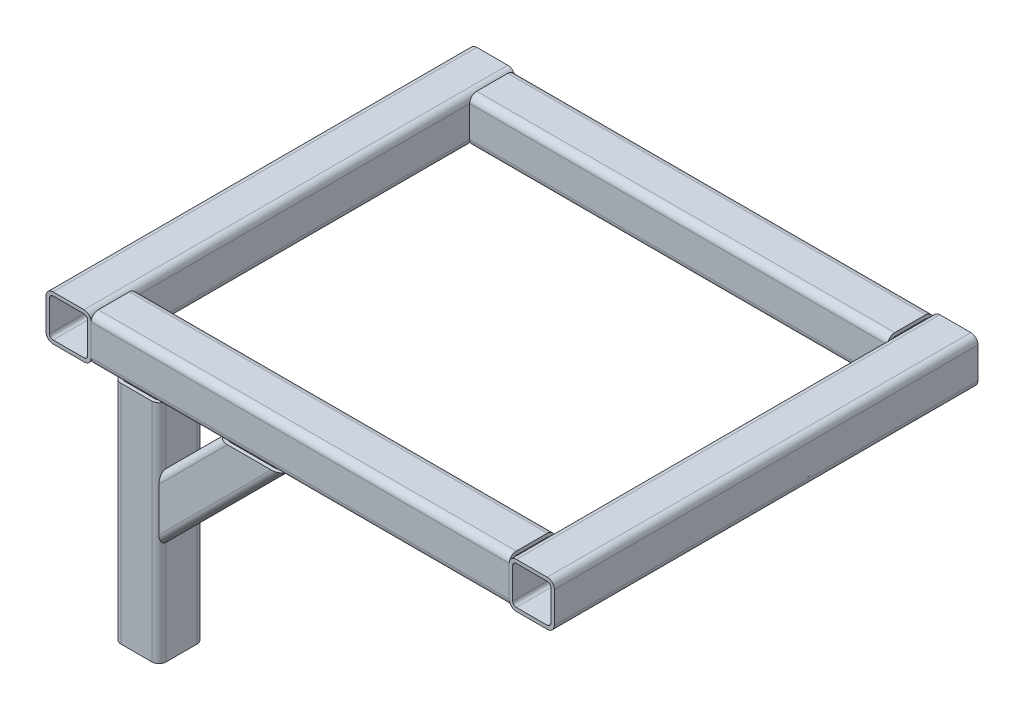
SolidWorks part; units mm, degrees
ref_plane "Front Plane" through (0, 0, 0) normal (0, 0, 1) x (1, 0, 0)
ref_plane "Top Plane" through (0, 0, 0) normal (0, 1, 0) x (1, 0, 0)
ref_plane "Right Plane" through (0, 0, 0) normal (1, 0, 0) x (0, 0, -1)
ref_plane "Top of Frame" through (0, 500, 0) normal (0, 1, 0) x (1, 0, 0)
ref_plane "Bottom of Legs" through (0, 20, 0) normal (0, 1, 0) x (1, 0, 0)
sketch "Upper Frame" plane through (0, 500, 0) normal (0, 1, 0) x (1, 0, 0)
  line L0 (-450, 375) -> (450, -375) construction
  line L1 (450, 375) -> (-450, 375)
  line L2 (450, 375) -> (450, -375)
  line L3 (450, -375) -> (-450, -375)
  line L4 (-450, 375) -> (-450, -375)
  dimension "D1" = 900
  dimension "D2" = 750
ref_plane "Front of Frame" through (0, 0, 375) normal (0, 0, 1) x (1, 0, 0)
sketch "Leg Sketch" plane through (0, 0, 375) normal (0, 0, 1) x (1, 0, 0)
  line L0 (-290, 20) -> (-290, 500)
  line L1 (0, 429.9862) -> (0, 0) construction
  line L2 (-290, 220) -> (-10, 500)
  line L3 (450, 500) -> (-450, 500) construction
  line L4 (50, 20) -> (-50, 20) construction
  dimension "D1" = 200
  dimension "D2" = 45
  dimension "D3" = 580
other "Tube (square) 80 X 80 X 6.3(1)"
ref_plane "Plane2" through (410, 460, -375) normal (0, 0, 1) x (1, 0, 0)
sketch "Sketch1" plane through (410, 460, -375) normal (0, 0, 1) x (1, 0, 0)
  line L0 (-27.4, -33.7) -> (27.4, -33.7)
  line L1 (-33.7, -27.4) -> (-33.7, 27.4)
  line L2 (27.4, 33.7) -> (-27.4, 33.7)
  line L3 (33.7, 27.4) -> (33.7, -27.4)
  line L4 (-27.4, -40) -> (27.4, -40)
  line L5 (-40, -27.4) -> (-40, 27.4)
  line L6 (27.4, 40) -> (-27.4, 40)
  line L7 (40, 27.4) -> (40, -27.4)
  line L8 (-40, 0) -> (-33.7, 0) construction
  line L9 (-33.7, 0) -> (33.7, 0) construction
  line L10 (33.7, 0) -> (40, 0) construction
  line L12 (0, 40) -> (0, 33.7) construction
  line L13 (0, 33.7) -> (0, -33.7) construction
  line L14 (0, -33.7) -> (0, -40) construction
  arc A0 (40, 27.4) -> (27.4, 40) centre (27.4, 27.4) ccw
  arc A1 (27.4, -40) -> (40, -27.4) centre (27.4, -27.4) ccw
  arc A2 (-40, -27.4) -> (-27.4, -40) centre (-27.4, -27.4) ccw
  arc A3 (-27.4, 40) -> (-40, 27.4) centre (-27.4, 27.4) ccw
  arc A4 (-27.4, 33.7) -> (-33.7, 27.4) centre (-27.4, 27.4) ccw
  arc A5 (33.7, 27.4) -> (27.4, 33.7) centre (27.4, 27.4) ccw
  arc A6 (27.4, -33.7) -> (33.7, -27.4) centre (27.4, -27.4) ccw
  arc A7 (-33.7, -27.4) -> (-27.4, -33.7) centre (-27.4, -27.4) ccw
  point P2 (-40, 40)
  point P33 (-40, -40)
  point P34 (40, -40)
  point P36 (40, 40)
  point P37 (0, 0)
  dimension "D1" = 12.6
  dimension "Thickness" = 6.3
  dimension "V_leg" = 80
  dimension "H_leg" = 80
